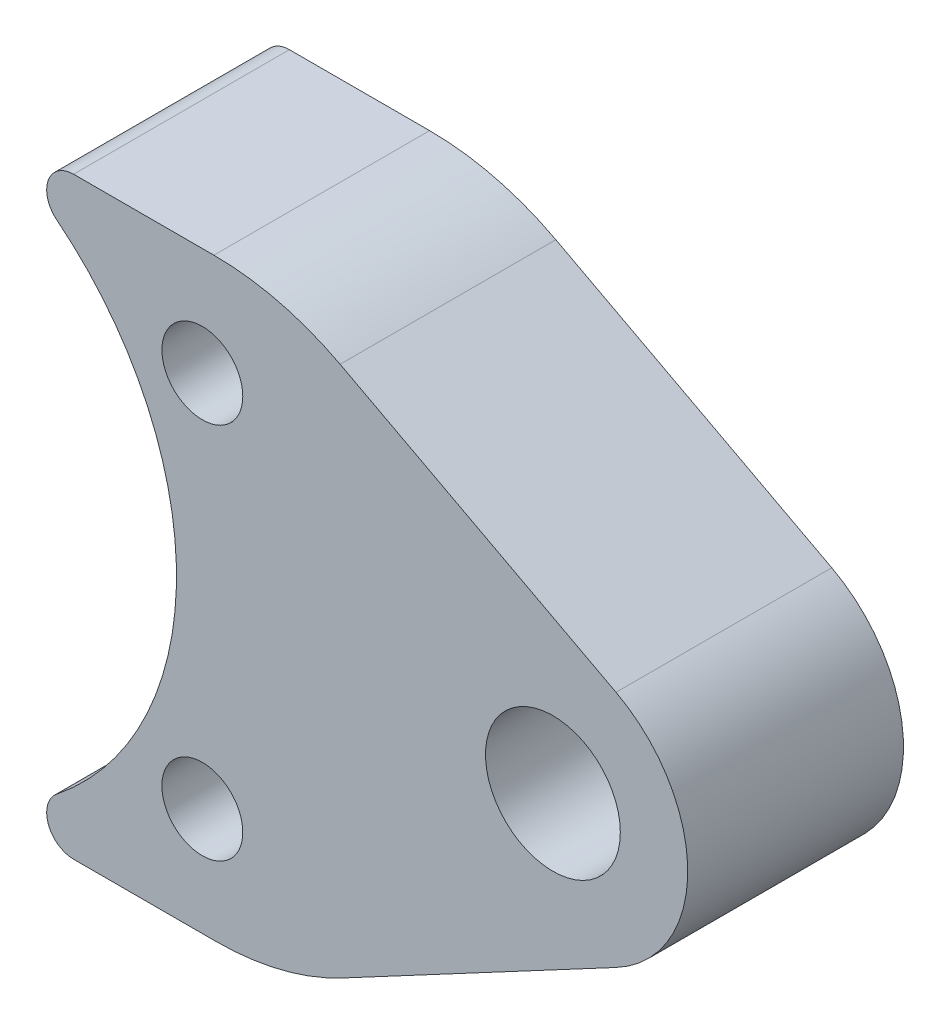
SolidWorks part; units mm, degrees
ref_plane "Plan de face" through (0, 0, 0) normal (0, 0, 1) x (1, 0, 0)
ref_plane "Plan de dessus" through (0, 0, 0) normal (0, 1, 0) x (1, 0, 0)
ref_plane "Plan de droite" through (0, 0, 0) normal (1, 0, 0) x (0, 0, -1)
sketch "Esquisse1" plane through (0, 0, 0) normal (0, 0, 1) x (1, 0, 0)
  line L0 (20, -11) -> (12.2279, -11)
  line L1 (19.9133, 11) -> (32.3401, 4.4186)
  line L2 (19.9133, 11) -> (12.2279, 11)
  line L3 (0, 0) -> (22.9627, 0) construction
  line L4 (20, -11) -> (32.3529, -4.4118)
  circle A0 centre (17, 7) radius 1.5
  arc A1 (12.2279, 11) -> (11.6043, 9.2183) centre (12.2279, 10) ccw
  arc A2 (32.3401, 4.4186) -> (32.3529, -4.4118) centre (30, 0) cw
  arc A4 (12.2279, -11) -> (11.6043, -9.2183) centre (12.2279, -10) cw
  circle A5 centre (17, -7) radius 1.5
  circle A6 centre (30, 0) radius 2.5
  arc A7 (11.6043, 9.2183) -> (11.6043, -9.2183) centre (4.25, 0) cw
  dimension "D1" = 3
  dimension "D2" = 1
  dimension "D4" = 30
  dimension "D6" = 5
  dimension "D5" = 5
  dimension "D3" = 17
extrude "Extrusion1" add sketch "Esquisse1" along normal blind 8
fillet "Congé1" radius 10 2 edges at (19.9133, 11, 4) (20, -11, 4)
